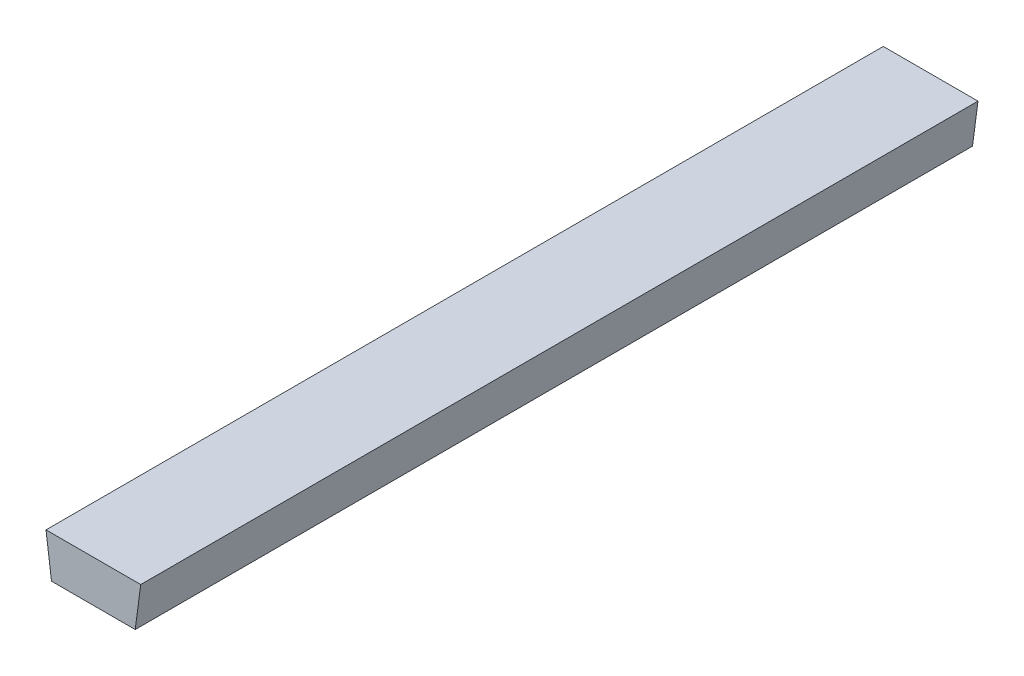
SolidWorks part; units mm, degrees
ref_plane "Plan de face" through (0, 0, 0) normal (0, 0, 1) x (1, 0, 0)
ref_plane "Plan de dessus" through (0, 0, 0) normal (0, 1, 0) x (1, 0, 0)
ref_plane "Plan de droite" through (0, 0, 0) normal (1, 0, 0) x (0, 0, -1)
sketch "Esquisse3" plane through (0, 0, 0) normal (0, 0, 1) x (1, 0, 0)
  line L0 (-20, 0) -> (20, 0)
  line L1 (20, 0) -> (22.6249, 19.9381)
  line L2 (22.6249, 19.9381) -> (-22.6249, 19.9381)
  line L4 (-20, 0) -> (-22.6249, 19.9381)
  dimension "D1" = 40
  dimension "D2" = 97.5
  dimension "D3" = 97.5
extrude "Extrusion1" add sketch "Esquisse3" along normal blind 400
